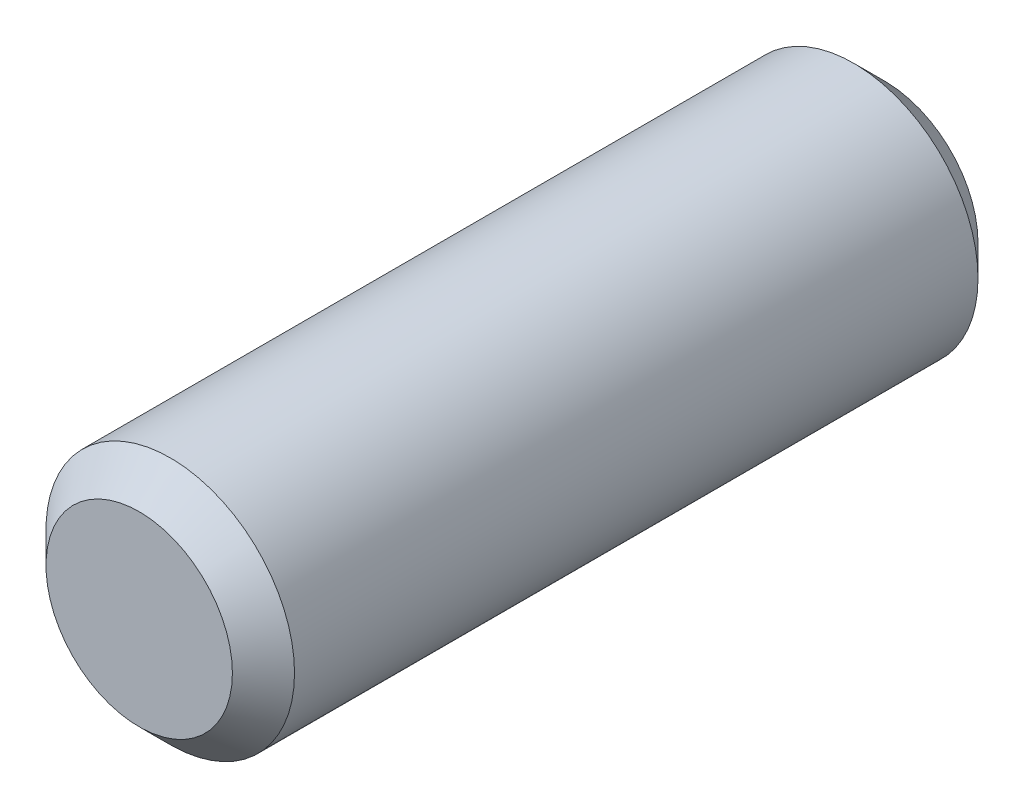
SolidWorks part; units mm, degrees
ref_plane "Front Plane" through (0, 0, 0) normal (0, 0, 1) x (1, 0, 0)
ref_plane "Top Plane" through (0, 0, 0) normal (0, 1, 0) x (1, 0, 0)
ref_plane "Right Plane" through (0, 0, 0) normal (1, 0, 0) x (0, 0, -1)
sketch "Sketch1" plane through (0, 0, 0) normal (1, 0, 0) x (0, 0, -1)
  line L0 (10.6747, 0) -> (50010.6747, 0) construction
  line L1 (0, 0) -> (6, 0)
  line L6 (0.25, 1) -> (0, 0.75)
  line L7 (0, 0.75) -> (0, 0)
  line L8 (5.75, 1) -> (0.25, 1)
  line L9 (6, 0.75) -> (5.75, 1)
  line L10 (6, 0) -> (6, 0.75)
  dimension "D1" = 45
  dimension "D2" = 45
  dimension "D3" = 6
  dimension "D4" = 0.25
  dimension "D5" = 2
revolve "Revolve1" add sketch "Sketch1" angle 360 about L0
